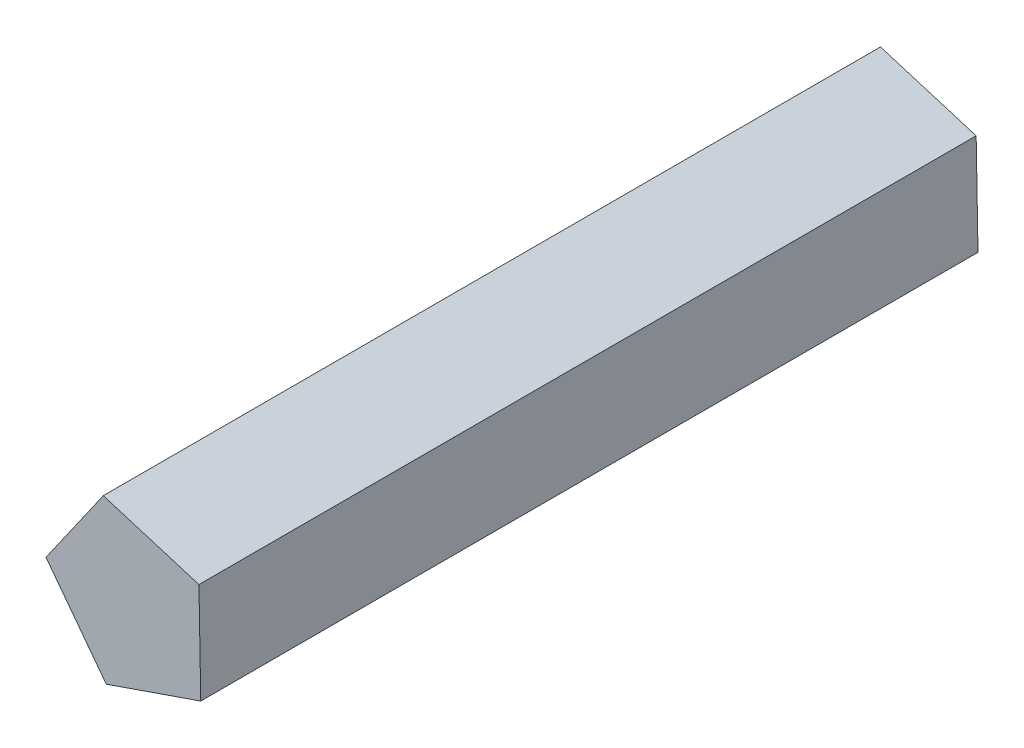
SolidWorks part; units mm, degrees
ref_plane "Front Plane" through (0, 0, 0) normal (0, 0, 1) x (1, 0, 0)
ref_plane "Top Plane" through (0, 0, 0) normal (0, 1, 0) x (1, 0, 0)
ref_plane "Right Plane" through (0, 0, 0) normal (1, 0, 0) x (0, 0, -1)
sketch "Sketch1" plane through (0, 0, 0) normal (0, 0, 1) x (1, 0, 0)
  line L7 (14.0539, 2.2543) -> (13.9971, 5.3416)
  line L8 (13.9971, 5.3416) -> (11.0433, 6.2415)
  line L9 (11.0433, 6.2415) -> (9.2747, 3.7104)
  line L10 (9.2747, 3.7104) -> (11.1353, 1.2462)
  line L11 (11.1353, 1.2462) -> (14.0539, 2.2543)
  circle A0 centre (11.9009, 3.7588) radius 2.125 construction
  point P1 (0, 0)
  dimension "D1" = 4.25
extrude "Boss-Extrude1" add sketch "Sketch1" along normal blind 24 contours L7 L8 L9 L10 L11
